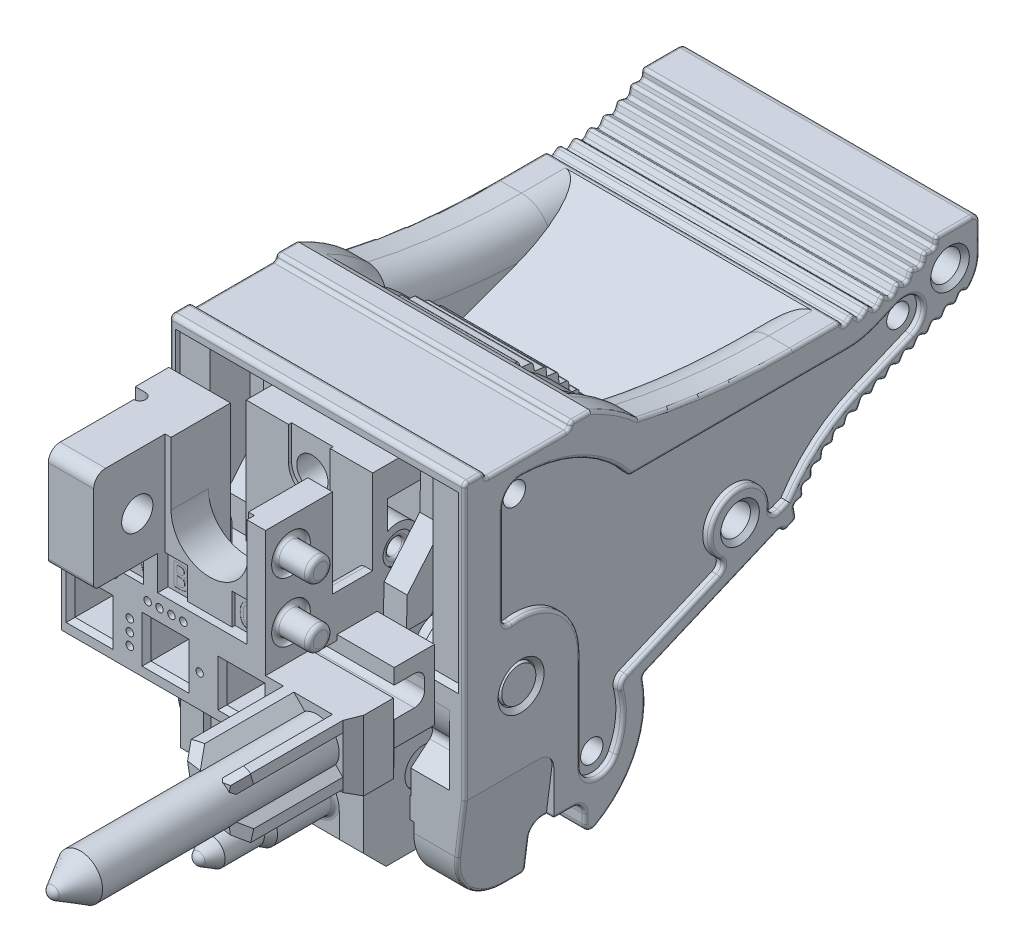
SolidWorks part; units mm, degrees
ref_plane "前视基准面" through (0, 0, 0) normal (0, 0, 1) x (1, 0, 0)
ref_plane "上视基准面" through (0, 0, 0) normal (0, 1, 0) x (1, 0, 0)
ref_plane "右视基准面" through (0, 0, 0) normal (1, 0, 0) x (0, 0, -1)
imported_body "输入1"
imported_body "输入3"
imported_body "输入4"
imported_body "输入8"
sketch "草图1" plane through (0, 0, -22.5744) normal (0, 0, 1) x (1, 0, 0)
  line L0 (-2.644, 99.8262) -> (-1.138, 99.8262) construction
  line L1 (-2.644, 98.0162) -> (-2.644, 100.1246) construction
  line L2 (-1.138, 98.0162) -> (-1.138, 100.1246) construction
  line L3 (-1.138, 98.0162) -> (-2.644, 98.0162) construction
  line L5 (-5.656, 99.8262) -> (-7.162, 99.8262) construction
  line L6 (-5.656, 100.1246) -> (-5.656, 98.0162) construction
  line L7 (-7.162, 100.1246) -> (-7.162, 98.0162) construction
  text T0 "F" font "黑体" height 1.5
  text T1 "E" font "黑体" height 1.5
  dimension "D1" = 1.81
extrude "切除-拉伸1" cut sketch "草图1" against normal blind 0.1
sketch "草图2" plane through (0, 0, -22.0724) normal (0, 0, 1) x (1, 0, 0)
  line L0 (-9.6218, 99.8246) -> (-8.1158, 99.8246) construction
  line L1 (-9.6218, 98.0162) -> (-9.6218, 100.1246) construction
  line L2 (-8.1158, 100.1246) -> (-8.1158, 98.0162) construction
  line L3 (-9.6218, 100.1246) -> (-8.1158, 100.1246) construction
  text T0 "D" font "黑体" height 1.5
  dimension "D1" = 0.3
extrude "切除-拉伸2" cut sketch "草图2" against normal blind 0.1
mirror "镜向1" about plane through (0, 0, 0) normal (0, 1, 0)
sketch "草图3" plane through (0, 0, 0) normal (0, 1, 0) x (1, 0, 0)
  line L1 (112.9049, 115.5411) -> (-48.9304, 115.5411)
  line L2 (112.9049, 115.5411) -> (112.9049, -83.1249)
  line L3 (112.9049, -83.1249) -> (-48.9304, -83.1249)
  line L4 (-48.9304, 115.5411) -> (-48.9304, -83.1249)
extrude "切除-拉伸3" cut sketch "草图3" along normal through all
sketch "草图4" plane through (0, 0, -22.0724) normal (0, 0, 1) x (1, 0, 0)
  line L0 (-8.1158, -100.1246) -> (-8.1158, -98.0162) construction
  line L1 (-9.6218, -98.0162) -> (-8.1158, -98.0162)
  line L2 (-9.6218, -98.0162) -> (-9.6218, -100.1246)
  line L3 (-9.6218, -100.1246) -> (-8.1158, -100.1246)
  line L4 (-8.1158, -98.0162) -> (-8.1158, -100.1246)
  line L5 (-8.1158, -100.1246) -> (-8.1158, -98.0162) construction
extrude "切除-拉伸4" cut sketch "草图4" against normal blind 0.1
sketch "草图5" plane through (0, 0, -22.5744) normal (0, 0, 1) x (1, 0, 0)
  line L0 (-7.162, -97.8154) -> (-7.162, -100.1246) construction
  line L1 (-7.162, -98.0162) -> (-5.656, -98.0162)
  line L2 (-7.162, -98.0162) -> (-7.162, -100.1246)
  line L3 (-7.162, -100.1246) -> (-5.656, -100.1246)
  line L4 (-5.656, -98.0162) -> (-5.656, -100.1246)
  line L5 (-5.656, -98.0162) -> (-7.162, -98.0162) construction
  line L6 (-5.656, -100.1246) -> (-5.656, -98.0162) construction
  line L8 (-2.644, -98.0162) -> (-1.138, -98.0162)
  line L9 (-2.644, -98.0162) -> (-2.644, -100.1246)
  line L10 (-2.644, -100.1246) -> (-1.138, -100.1246)
  line L11 (-1.138, -98.0162) -> (-1.138, -100.1246)
extrude "凸台-拉伸1" add sketch "草图5" along normal blind 0.1
sketch "草图6" plane through (0, 0, -22.1724) normal (0, 0, 1) x (1, 0, 0)
  line L0 (-9.4218, -99.8246) -> (-7.7474, -99.8246) construction
  line L5 (-9.6218, -100.1246) -> (-8.1158, -100.1246) construction
  line L6 (-9.6218, -98.0162) -> (-9.6218, -100.1246) construction
  text T0 "A" font "黑体" height 1.5
  dimension "D1" = 0.2
  dimension "D2" = 0.3
extrude "切除-拉伸5" cut sketch "草图6" against normal blind 0.01
sketch "草图7" plane through (0, 0, -22.4744) normal (0, 0, 1) x (1, 0, 0)
  line L0 (-6.862, -99.9246) -> (-1.0452, -99.9246) construction
  line L1 (-7.162, -97.8154) -> (-7.162, -100.1246) construction
  line L2 (-7.162, -100.1246) -> (-1.138, -100.1246) construction
  text T0 "B   C" font "黑体" height 1.5
  dimension "D1" = 0.3
  dimension "D2" = 0.2
extrude "切除-拉伸6" cut sketch "草图7" against normal blind 0.01
